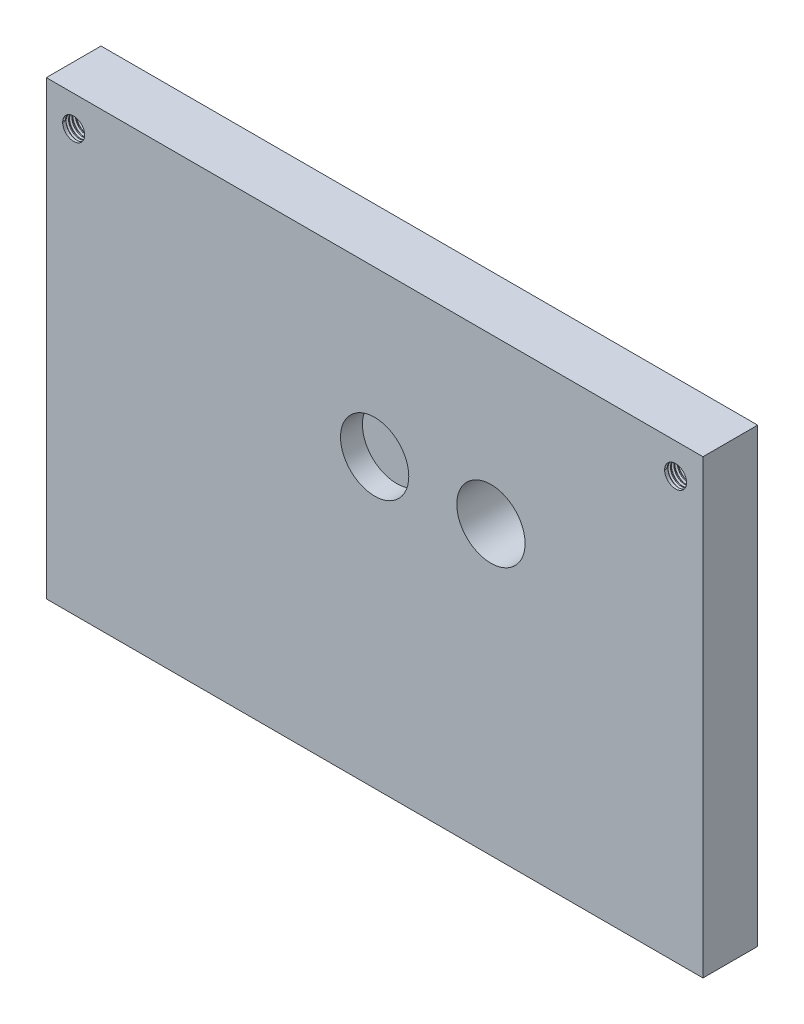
SolidWorks part; units mm, degrees
ref_plane "Front Plane" through (0, 0, 0) normal (0, 0, 1) x (1, 0, 0)
ref_plane "Top Plane" through (0, 0, 0) normal (0, 1, 0) x (1, 0, 0)
ref_plane "Right Plane" through (0, 0, 0) normal (1, 0, 0) x (0, 0, -1)
sketch "Sketch1" plane through (0, 0, 0) normal (0, 0, 1) x (1, 0, 0)
  line L0 (0, -14.2875) -> (0, 30.26) construction
  line L1 (-76.2, -66.675) -> (76.2, -66.675)
  line L2 (-76.2, -66.675) -> (-76.2, 38.1)
  line L3 (-76.2, 38.1) -> (76.2, 38.1)
  line L4 (76.2, -66.675) -> (76.2, 38.1)
  line L5 (-76.2, -66.675) -> (76.2, 38.1) construction
  line L6 (-76.2, 38.1) -> (76.2, -66.675) construction
  point P0 (0, -14.2875)
  dimension "D4" = 66.675
  dimension "D1" = 152.4
  dimension "D2" = 104.775
  dimension "D3" = 0
extrude "Boss-Extrude2" add sketch "Sketch1" along normal blind 12.7 contours L2 L3 L4 L1
sketch "Sketch2" plane through (0, 0, 12.7) normal (0, 0, 1) x (1, 0, 0)
  circle A0 centre (0, 0) radius 7.9223
  circle A1 centre (26.9875, 0) radius 7.9223
  dimension "D1" = 26.9875
  dimension "D2" = 15.8445
  dimension "D3" = 15.8445
extrude "Cut-Extrude2" cut sketch "Sketch2" against normal blind 12.7
sketch "Sketch35" plane through (0, -66.675, 0) normal (0, -1, 0) x (-1, 0, 0)
  line L0 (76.2, 0) -> (-76.2, 0) construction
  point P0 (0, -6.3907)
  point P1 (63.5, -6.3907)
  point P2 (-63.5, -6.3907)
  point P3 (0, 0)
  dimension "D1" = 63.5
  dimension "D2" = 6.3907
  dimension "D3" = 6.3907
hole_wizard "Tap Drill for #10-32 Tap4" positions "Sketch36" profile "Sketch37" hole size "#10-32" standard "ANSI Inch"
sketch "Sketch36" plane through (0, -66.675, 0) normal (0, -1, 0) x (-1, 0, 0)
  point P0 (63.5, -6.3907)
  point P3 (0, -6.3907)
  point P6 (-63.5, -6.3907)
sketch "Sketch37" plane through (-63.5, -66.675, 6.3907) normal (1, 0, 0) x (0, 0, -1)
  line L0 (0, 0) -> (0, 13.9133)
  line L1 (0, 13.9133) -> (2.0193, 12.7)
  line L2 (2.0193, 12.7) -> (2.0193, 0)
  line L5 (2.0193, 0) -> (0, 0)
  line L10 (0, 13.9133) -> (-2.0193, 12.7) construction
  line L11 (0, -6.35) -> (0, 107.95) construction
  dimension "Hole Dia." = 4.0386
  dimension "Hole Depth" = 12.7
  dimension "Drill Angle" = 118
thread "Thread11" pitch 0.7937 start angle 0, offset 0, length 12.7, pitch 0.7937, diameter 4.0386
ref_plane "Plane13" through (2.0193, -66.675, 6.3907) normal (0, 0, 1) x (0.9986, 0.0523, 0)
sketch "Thread Profile13" plane through (2.0193, -66.675, 6.3907) normal (0, 0, 1) x (0.9986, 0.0523, 0)
  line L0 (0, 0) -> (0, 0.7937) construction
  line L1 (0, 0) -> (0.4296, 0.248)
  line L2 (0.4296, 0.248) -> (0.4296, 0.3473)
  line L3 (0.4296, 0.3473) -> (0, 0.5953)
  line L4 (0.4296, 0.2977) -> (0, 0.2977) construction
  line L11 (0, 0) -> (0, 0.5953)
  point P2 (0, 0)
  dimension "Pitch" = 0.7937
  dimension "Profile_Angle" = 60
  dimension "Profile_Land" = 0.0992
  dimension "Profile_Height" = 0.4296
thread "Thread12" pitch 0.7937 start angle 0, offset 0, length 12.7, pitch 0.7937, diameter 4.0386
ref_plane "Plane14" through (61.4807, -53.975, 6.3907) normal (0, 0, 1) x (-0.9986, -0.0523, 0)
sketch "Thread Profile14" plane through (61.4807, -53.975, 6.3907) normal (0, 0, 1) x (-0.9986, -0.0523, 0)
  line L0 (0, 0) -> (0, 0.7937) construction
  line L1 (0, 0) -> (0.4296, 0.248)
  line L2 (0.4296, 0.248) -> (0.4296, 0.3473)
  line L3 (0.4296, 0.3473) -> (0, 0.5953)
  line L4 (0.4296, 0.2977) -> (0, 0.2977) construction
  line L11 (0, 0) -> (0, 0.5953)
  point P2 (0, 0)
  dimension "Pitch" = 0.7937
  dimension "Profile_Angle" = 60
  dimension "Profile_Land" = 0.0992
  dimension "Profile_Height" = 0.4296
sketch "Sketch48" plane through (0, 0, 12.7) normal (0, 0, 1) x (1, 0, 0)
  line L0 (-76.2, -66.675) -> (-76.2, 38.1) construction
  line L1 (0, -6.985) -> (0, 6.985) construction
  point P0 (-69.85, 30.9959)
  point P7 (69.85, 30.9959)
  dimension "D1" = 6.35
hole_wizard "Tap Drill for 1/4-20 Tap1" positions "Sketch49" profile "Sketch50" hole size "1/4-20" standard "ANSI Inch"
sketch "Sketch49" plane through (0, 0, 12.7) normal (0, 0, 1) x (1, 0, 0)
  point P0 (-69.85, 30.9959)
  point P3 (69.85, 30.9959)
sketch "Sketch50" plane through (-69.85, 30.9959, 12.7) normal (1, 0, 0) x (0, -1, 0)
  line L0 (0, 0) -> (0, 12.7)
  line L1 (0, 12.7) -> (2.5527, 12.7)
  line L2 (2.5527, 12.7) -> (2.5527, 0)
  line L5 (2.5527, 0) -> (0, 0)
  line L11 (0, -6.35) -> (0, 107.95) construction
  dimension "Thru Hole Dia." = 5.1054
  dimension "Thru Hole Depth" = 12.7
thread "Thread13" pitch 0.7937 start angle 0, offset 0, length 12.7, pitch 0.7937, diameter 5.1054
ref_plane "Plane15" through (-72.4027, 30.9959, 12.7) normal (0, -1, 0) x (-0.9986, 0, -0.0523)
sketch "Thread Profile15" plane through (-72.4027, 30.9959, 12.7) normal (0, -1, 0) x (-0.9986, 0, -0.0523)
  line L0 (0, 0) -> (0, 0.7937) construction
  line L1 (0, 0) -> (0.4296, 0.248)
  line L2 (0.4296, 0.248) -> (0.4296, 0.3473)
  line L3 (0.4296, 0.3473) -> (0, 0.5953)
  line L4 (0.4296, 0.2977) -> (0, 0.2977) construction
  line L11 (0, 0) -> (0, 0.5953)
  point P2 (0, 0)
  dimension "Pitch" = 0.7937
  dimension "Profile_Angle" = 60
  dimension "Profile_Land" = 0.0992
  dimension "Profile_Height" = 0.4296
thread "Thread14" pitch 0.7937 start angle 0, offset 0, length 12.7, pitch 0.7937, diameter 5.1054
ref_plane "Plane16" through (67.2973, 30.9959, 12.7) normal (0, -1, 0) x (-0.9986, 0, -0.0523)
sketch "Thread Profile16" plane through (67.2973, 30.9959, 12.7) normal (0, -1, 0) x (-0.9986, 0, -0.0523)
  line L0 (0, 0) -> (0, 0.7937) construction
  line L1 (0, 0) -> (0.4296, 0.248)
  line L2 (0.4296, 0.248) -> (0.4296, 0.3473)
  line L3 (0.4296, 0.3473) -> (0, 0.5953)
  line L4 (0.4296, 0.2977) -> (0, 0.2977) construction
  line L11 (0, 0) -> (0, 0.5953)
  point P2 (0, 0)
  dimension "Pitch" = 0.7937
  dimension "Profile_Angle" = 60
  dimension "Profile_Land" = 0.0992
  dimension "Profile_Height" = 0.4296
sketch "Sketch51" plane through (0, -66.675, 0) normal (0, -1, 0) x (1, 0, 0)
  circle A0 centre (-63.5, 6.3907) radius 2.413
  circle A1 centre (0, 6.3907) radius 2.413
  circle A2 centre (63.5, 6.3907) radius 2.413
extrude "Cut-Extrude3" cut sketch "Sketch51" against normal blind 19.05
thread "Thread10" pitch 0.7937 start angle 0, offset 0, length 19.05, pitch 0.7937, diameter 4.826
ref_plane "Plane12" through (-61.087, -66.675, 6.3907) normal (0, 0, 1) x (0.9986, 0.0523, 0)
sketch "Thread Profile12" plane through (-61.087, -66.675, 6.3907) normal (0, 0, 1) x (0.9986, 0.0523, 0)
  line L0 (0, 0) -> (0, 0.7937) construction
  line L1 (0, 0) -> (0.4296, 0.248)
  line L2 (0.4296, 0.248) -> (0.4296, 0.3473)
  line L3 (0.4296, 0.3473) -> (0, 0.5953)
  line L4 (0.4296, 0.2977) -> (0, 0.2977) construction
  line L11 (0, 0) -> (0, 0.5953)
  point P2 (0, 0)
  dimension "Pitch" = 0.7937
  dimension "Profile_Angle" = 60
  dimension "Profile_Land" = 0.0992
  dimension "Profile_Height" = 0.4296
pattern_linear "LPattern1" count 3 spacing 63.5 of "Thread10"
ref_plane "Plane17" through (0, 0, 6.35) normal (0, 0, 1) x (1, 0, 0)
sketch "Sketch52" plane through (0, 0, 6.35) normal (0, 0, 1) x (1, 0, 0)
  line L0 (-63.5, -66.675) -> (-63.5, -46.4209)
  line L1 (0, -66.675) -> (0, -46.4209)
  line L2 (63.5122, -66.675) -> (63.5122, -46.4209)
  line L3 (-76.2, -66.675) -> (76.2, -66.675) construction
ref_plane "Plane18" through (0, 0, 6.35) normal (0, 0, 1) x (1, 0, 0)
sketch "Sketch53" plane through (0, 0, 6.35) normal (0, 0, 1) x (1, 0, 0)
  circle A0 centre (0, 0) radius 7.9223
  dimension "D1" = 15.8445
extrude "Boss-Extrude3" add sketch "Sketch53" along normal mid plane 2.54
